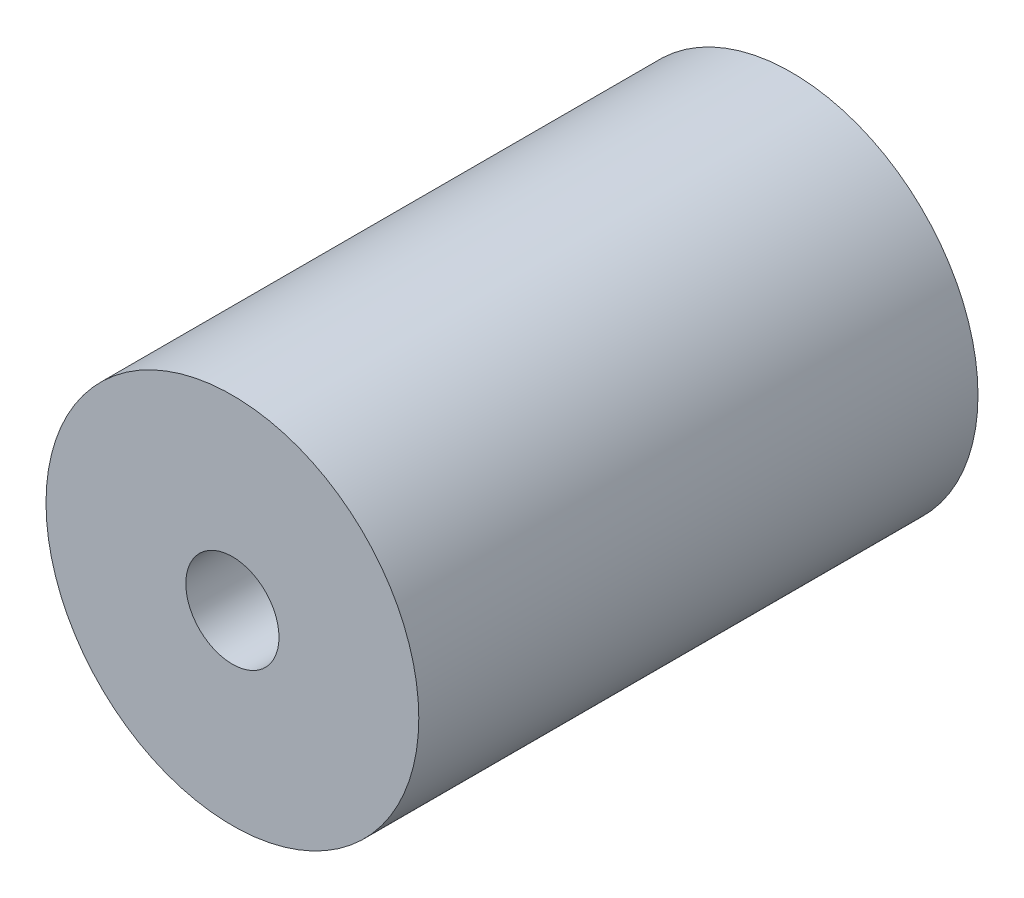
SolidWorks part; units mm, degrees
ref_plane "Plan de face" through (0, 0, 0) normal (0, 0, 1) x (1, 0, 0)
ref_plane "Plan de dessus" through (0, 0, 0) normal (0, 1, 0) x (1, 0, 0)
ref_plane "Plan de droite" through (0, 0, 0) normal (1, 0, 0) x (0, 0, -1)
sketch "Esquisse1" plane through (0, 0, 0) normal (0, 0, 1) x (1, 0, 0)
  circle A0 centre (0, 0) radius 200
  circle A1 centre (0, 0) radius 50
  dimension "D1" = 400
  dimension "D2" = 100
extrude "Extrusion1" add sketch "Esquisse1" along normal mid plane 600
